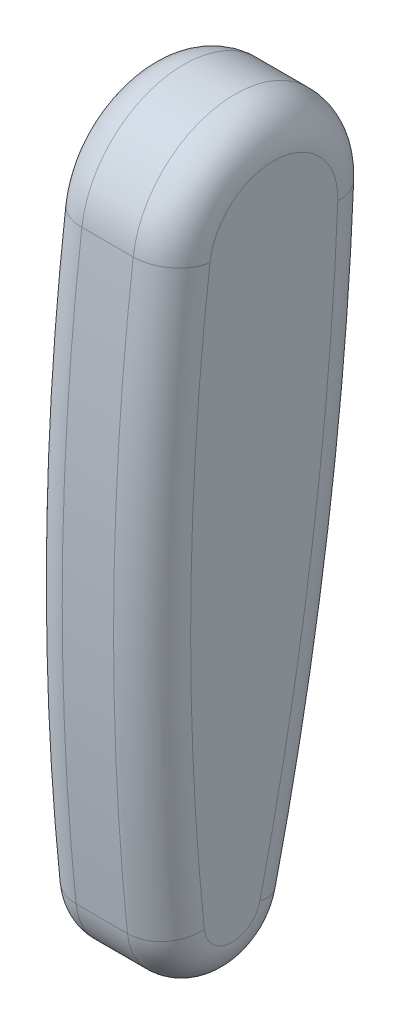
SolidWorks part; units mm, degrees
ref_plane "XY" through (0, 0, 0) normal (0, 0, 1) x (1, 0, 0)
ref_plane "YZ" through (0, 0, 0) normal (0, 1, 0) x (1, 0, 0)
ref_plane "XZ" through (0, 0, 0) normal (1, 0, 0) x (0, 0, -1)
ref_plane "Arm-plane" through (254, 0, 0) normal (1, 0, 0) x (0, 0, -1)
sketch "Sketch5" plane through (254, 0, 0) normal (-1, 0, 0) x (0, 0, 1)
  line L0 (-20.081, -363.1483) -> (-40.4939, -84.495) construction
  arc A0 (9.9184, -78.2306) -> (-91.2484, -86.6439) centre (-40.4939, -84.495) ccw
  arc A1 (-52.2259, -370.6996) -> (12.7609, -366.5734) centre (-20.081, -363.1483) ccw
  arc A2 (12.7609, -366.5734) -> (9.9184, -78.2306) centre (-1250.3885, -234.8403) ccw
  arc A3 (-91.2484, -86.6439) -> (-52.2259, -370.6996) centre (1431.3875, -22.1782) ccw
  dimension "D3" = 1524
  dimension "D4" = 1270
  dimension "D5" = 50.8
  dimension "D6" = 33.02
  dimension "D1" = 279.4
extrude "Base-Extrude" add sketch "Sketch5" along normal mid plane 63.5
fillet "Fillet1" radius 19.05 8 edges at (222.25, -229.5915, -78.4322) (222.25, -396.102, -17.9886) (222.25, -222.3211, 19.5498) (285.75, -396.102, -17.9886) (285.75, -229.5915, -78.4322) (285.75, -33.8698, -44.704) (285.75, -222.3211, 19.5498) (222.25, -33.8698, -44.704)
